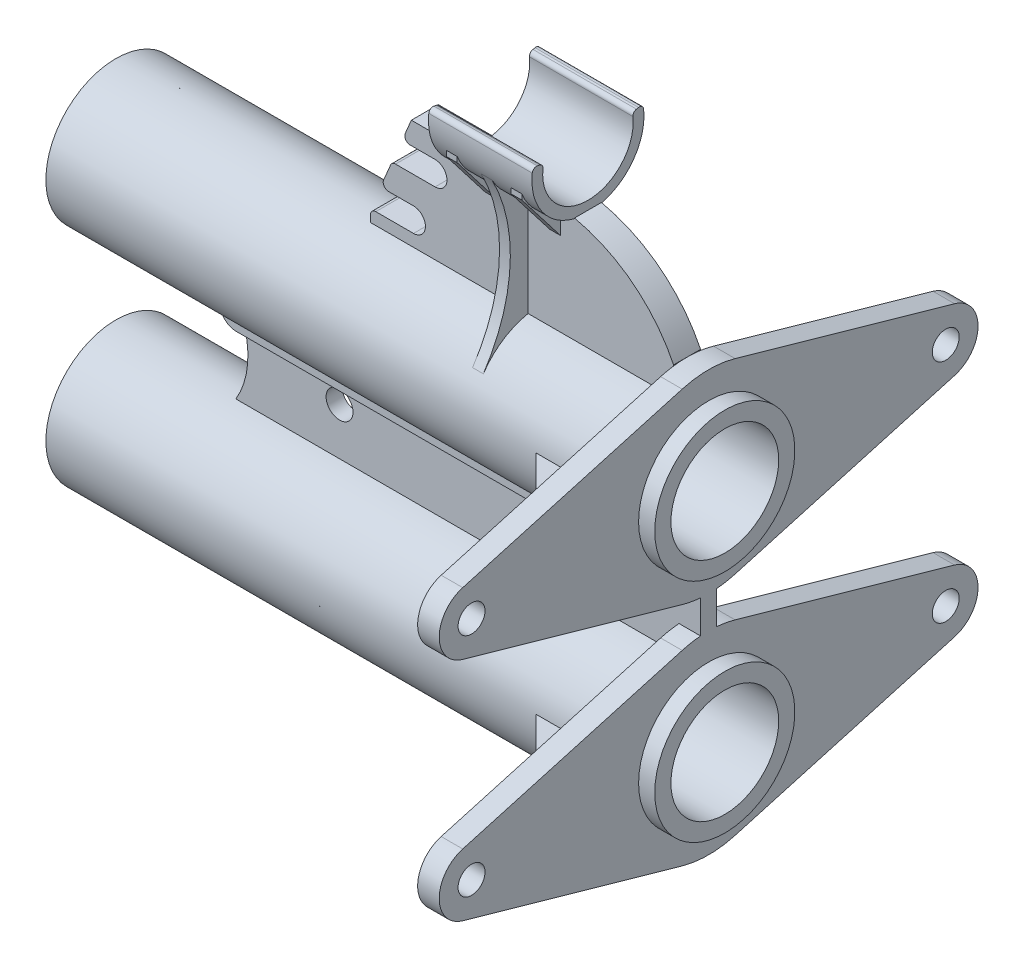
SolidWorks part; units mm, degrees
ref_plane "Front" through (0, 0, 0) normal (0, 0, 1) x (1, 0, 0)
ref_plane "Top" through (0, 0, 0) normal (0, 1, 0) x (1, 0, 0)
ref_plane "Right" through (0, 0, 0) normal (1, 0, 0) x (0, 0, -1)
sketch "Sketch1"
  dimension "D1" = 16.51
extrude "tube" add sketch "Sketch1" against normal blind 69.85
sketch "Sketch2"
  dimension "D2" = 7.62
  dimension "D4" = 3.175
  dimension "D3" = 63.5
  dimension "D1" = 3.175
extrude "flange" add sketch "Sketch2" against normal blind 2.54
sketch "Sketch3"
  dimension "D1" = 1.905
extrude "hole" cut sketch "Sketch3" against normal through all
sketch "Sketch4"
  dimension "D1" = 1.905
extrude "circular boss" add sketch "Sketch4" along normal blind 1.905
sketch "Sketch6"
  dimension "D1" = 0.9525
  dimension "D2" = 9.525
  dimension "D3" = 9.525
extrude "brace" add sketch "Sketch6" along normal mid plane 1.905
mirror "Mirror1" about plane through (0, 0, 0) normal (0, 0, 1)
sketch "Sketch5"
  dimension "D6" = 3.175
  dimension "D1" = 0.9525
  dimension "D2" = 53.34
  dimension "D3" = 55.372
  dimension "D4" = 0.9525
  dimension "D5" = 10.16
  dimension "D7" = 12.7
  dimension "D8" = 29.845
  dimension "D9" = 5.4864
extrude "center plate" add sketch "Sketch5" along normal mid plane 1.905
pattern_linear "upper tube&flange" count 2 spacing 26.67
sketch "Sketch7"
  dimension "D3" = 5.08
  dimension "D1" = 12.7
  dimension "D2" = 15.24
  dimension "D5" = 7.62
  dimension "D6" = 1.27
  dimension "D7" = 30.9055
  dimension "D8" = 35.7315
  dimension "D9" = 2.6063
  dimension "D4" = 0.9525
extrude "sight" add sketch "Sketch7" along normal mid plane 3.175
fillet "R025" radius 0.635
ref_plane "centersupport" through (-20.32, 0, 0) normal (1, 0, 0) x (0, 0, -1)
sketch "Sketch8"
  dimension "D1" = 13.208
  dimension "D2" = 1.27
  dimension "D3" = 0.635
extrude "ammo holder" add sketch "Sketch8" along normal mid plane 12.192 thin
fillet "R020" radius 0.508
sketch "Sketch9"
  dimension "D1" = 3.683
extrude "support" add sketch "Sketch9" against normal mid plane 1.27
ref_plane "brace plane" through (-23.495, 0, 0) normal (-1, 0, 0) x (0, 0, 1)
sketch "Sketch10"
  dimension "D1" = 2.54
  dimension "D3" = 0.635
  dimension "D2" = 0.127
extrude "support brace" add sketch "Sketch10" along normal blind 1.27
mirror "Mirror2" about plane through (-20.32, 0, 0) normal (1, 0, 0)
sketch "Sketch11"
  dimension "D1" = 1.905
  dimension "D2" = 1.905
extrude "rail" add sketch "Sketch11" along normal up to surface (51.5061 mm away)
fillet "R075" radius 1.905
mirror "Mirror3" about plane through (0, 0, 0) normal (0, 0, 1)
other "SurfaceCut1"
